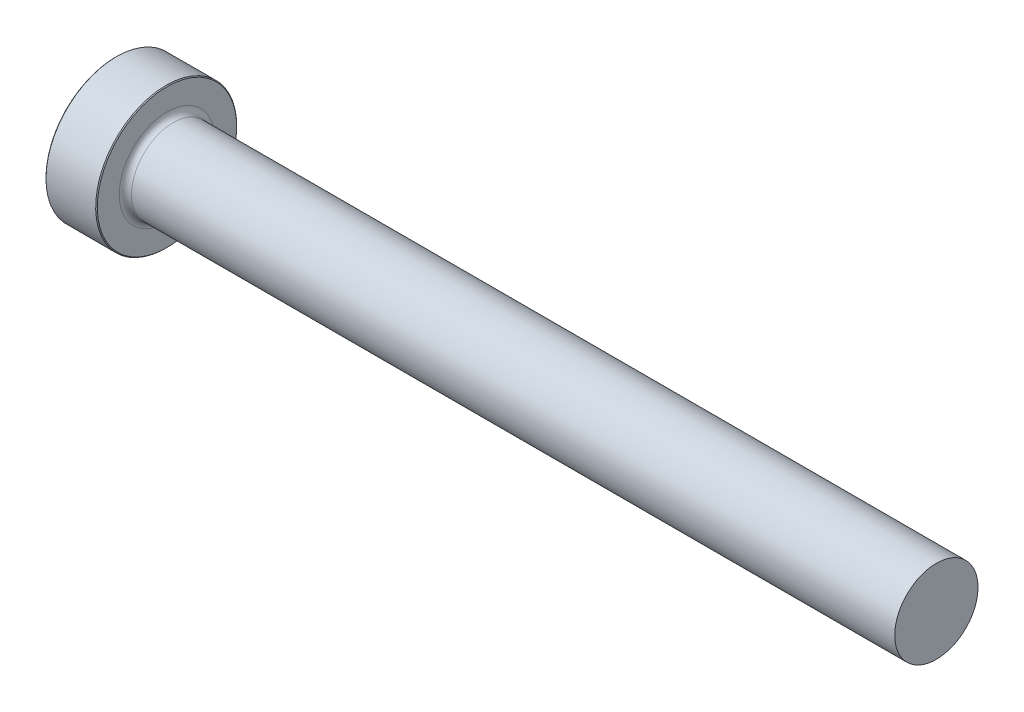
SolidWorks part; units mm, degrees
ref_plane "Front Plane" through (0, 0, 0) normal (0, 0, 1) x (1, 0, 0)
ref_plane "Top Plane" through (0, 0, 0) normal (0, 1, 0) x (1, 0, 0)
ref_plane "Right Plane" through (0, 0, 0) normal (1, 0, 0) x (0, 0, -1)
sketch "Sketch1" plane through (0, 0, 0) normal (0, 0, 1) x (1, 0, 0)
  line L0 (0, 0) -> (0, 8.7312)
  line L1 (0, 8.7312) -> (6.35, 8.7312)
  line L2 (6.35, 8.7312) -> (6.35, 5.9176)
  line L3 (7.112, 5.1556) -> (101.6, 5.1556)
  line L4 (101.6, 5.1556) -> (101.6, 0)
  line L5 (101.6, 0) -> (0, 0)
  line L6 (101.6, 0) -> (101.6, -5.1556) construction
  line L7 (101.6, -5.1556) -> (6.35, -5.1556) construction
  line L8 (0, 0) -> (0, -8.7312) construction
  line L9 (0, -8.7312) -> (6.35, -8.7312) construction
  line L10 (6.35, -8.7312) -> (6.35, -5.1556) construction
  arc A0 (6.35, 5.9176) -> (7.112, 5.1556) centre (7.112, 5.9176) ccw
  dimension "D4" = 0.762
  dimension "L" = 101.6
  dimension "D" = 10.3111
  dimension "H" = 17.4625
  dimension "T" = 6.35
revolve "Revolve1" add sketch "Sketch1" angle 360 about L5
chamfer "Chamfer1" distance 0.1016 angle 45 2 edges at (0, 8.7312, 0) (6.35, 8.7313, 0)
